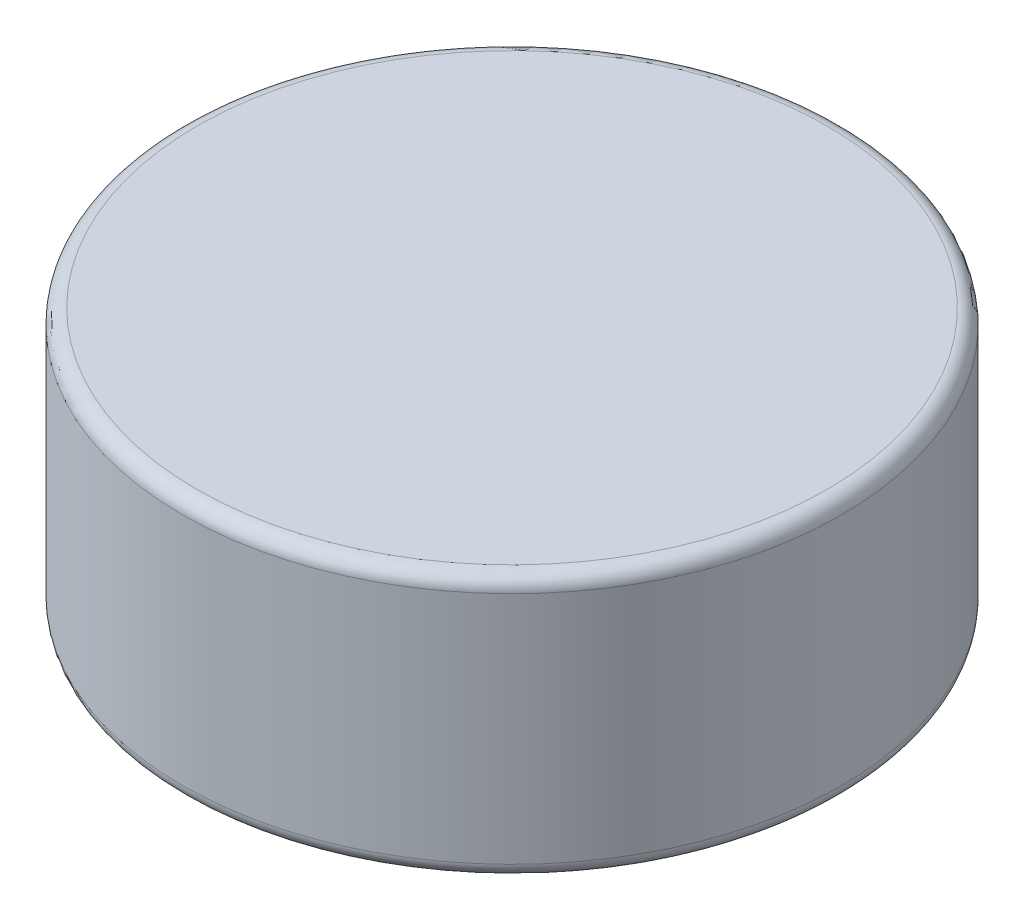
SolidWorks part; units mm, degrees
ref_plane "Front Plane" through (0, 0, 0) normal (0, 0, 1) x (1, 0, 0)
ref_plane "Top Plane" through (0, 0, 0) normal (0, 1, 0) x (1, 0, 0)
ref_plane "Right Plane" through (0, 0, 0) normal (1, 0, 0) x (0, 0, -1)
sketch "Sketch1" plane through (0, 0, 0) normal (0, 1, 0) x (1, 0, 0)
  circle A0 centre (0, 0) radius 22.5
  dimension "D1" = 45
extrude "Boss-Extrude1" add sketch "Sketch1" along normal blind 18
fillet "Fillet1" radius 1 2 edges at (0, 0, 22.5) (0, 18, 22.5)
